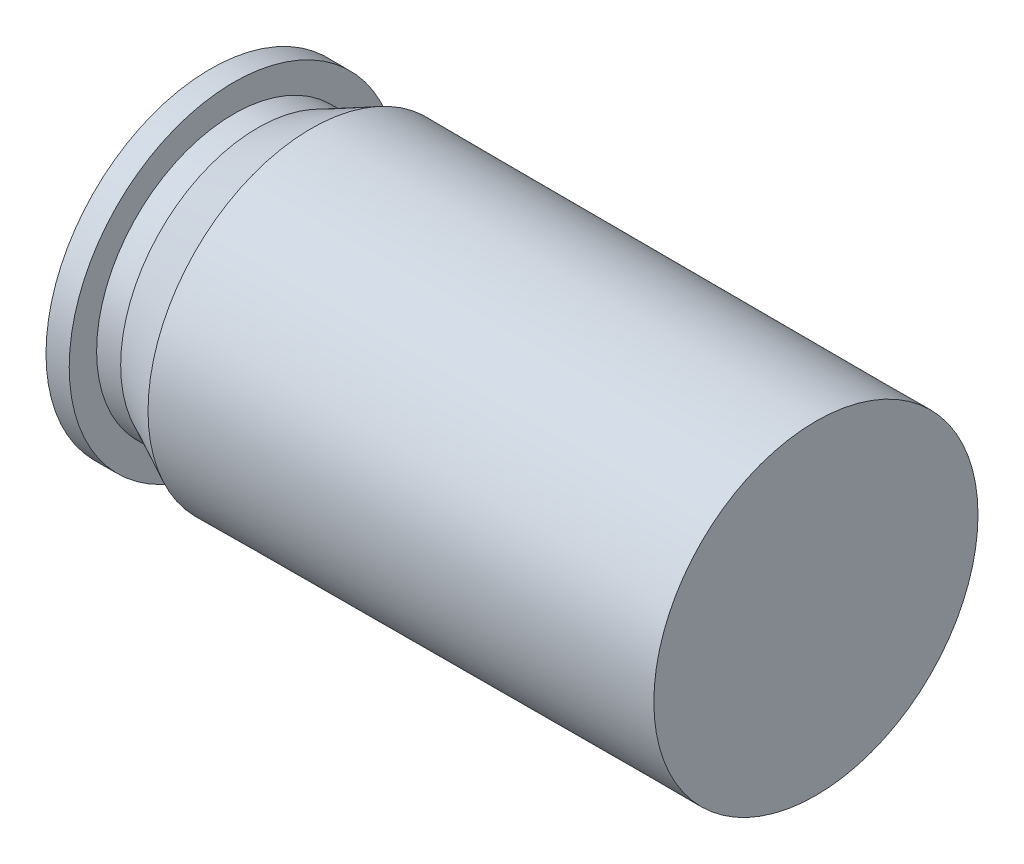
SolidWorks part; units mm, degrees
ref_plane "Front Plane" through (0, 0, 0) normal (0, 0, 1) x (1, 0, 0)
ref_plane "Top Plane" through (0, 0, 0) normal (0, 1, 0) x (1, 0, 0)
ref_plane "Right Plane" through (0, 0, 0) normal (1, 0, 0) x (0, 0, -1)
sketch "Sketch1" plane through (0, 0, 0) normal (0, 0, 1) x (1, 0, 0)
  line L0 (0, 0) -> (79.4536, 0) construction
  line L1 (0, 0) -> (0, 5.5523)
  line L2 (0.38, 6.095) -> (1.24, 6.095)
  line L3 (1.24, 6.095) -> (1.24, 5.08)
  line L4 (1.24, 5.08) -> (2.1315, 5.08)
  line L5 (2.1315, 5.08) -> (4.11, 6.045)
  line L6 (4.11, 6.045) -> (22.81, 6.005)
  line L7 (22.81, 6.005) -> (22.81, 0)
  line L8 (0, 5.5523) -> (0.38, 6.095)
  line L9 (0, 0) -> (22.6411, 0)
  line L10 (22.81, 0) -> (22.6411, 0)
  point P4 (0, 6.095)
  dimension "D1" = 6.095
  dimension "D2" = 10.16
  dimension "D3" = 12.09
  dimension "D4" = 26
  dimension "D5" = 4.11
  dimension "D6" = 1.24
  dimension "D7" = 22.81
  dimension "D8" = 12.01
  dimension "D11" = 0.38
  dimension "D12" = 35
revolve "Revolve2" add sketch "Sketch1" angle 360 about L0
sketch "Sketch2" plane through (0, 0, 0) normal (-1, 0, 0) x (0, 0, 1)
  text T0 "                 45 AUTO " font "Century Gothic" height 1.5
extrude "Cut-Extrude1" cut sketch "Sketch2" against normal blind 0.25
sketch "Sketch3" plane through (0, 0, 0) normal (-1, 0, 0) x (0, 0, 1)
  circle A0 centre (0, 0) radius 3.0189 construction
  text T1 "                 P M C" font "Century Gothic" height 1.5
extrude "Cut-Extrude2" cut sketch "Sketch3" against normal blind 0.25
